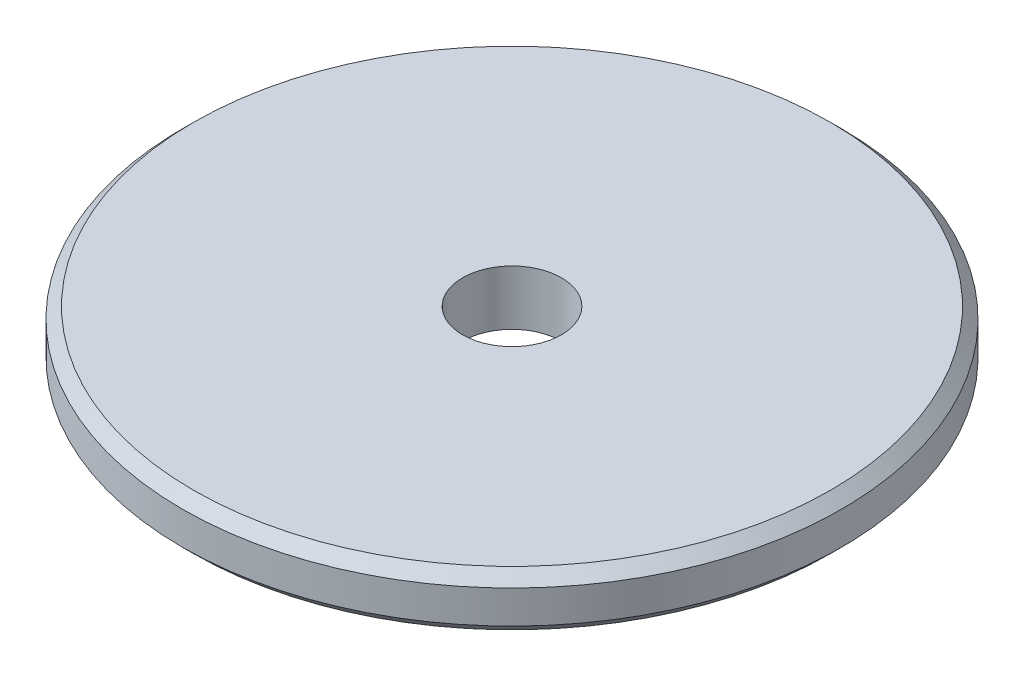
SolidWorks part; units mm, degrees
ref_plane "Front Plane" through (0, 0, 0) normal (0, 0, 1) x (1, 0, 0)
ref_plane "Top Plane" through (0, 0, 0) normal (0, 1, 0) x (1, 0, 0)
ref_plane "Right Plane" through (0, 0, 0) normal (1, 0, 0) x (0, 0, -1)
sketch "Sketch1" plane through (0, 0, 0) normal (0, 1, 0) x (1, 0, 0)
  circle A0 centre (0, 0) radius 30
  circle A1 centre (0, 0) radius 4.5
  dimension "D1" = 9
  dimension "D2" = 60
extrude "Extrude1" add sketch "Sketch1" along normal blind 5
chamfer "Chamfer1" distance 1 angle 45 2 edges at (0, 0, 30) (0, 5, 30)
